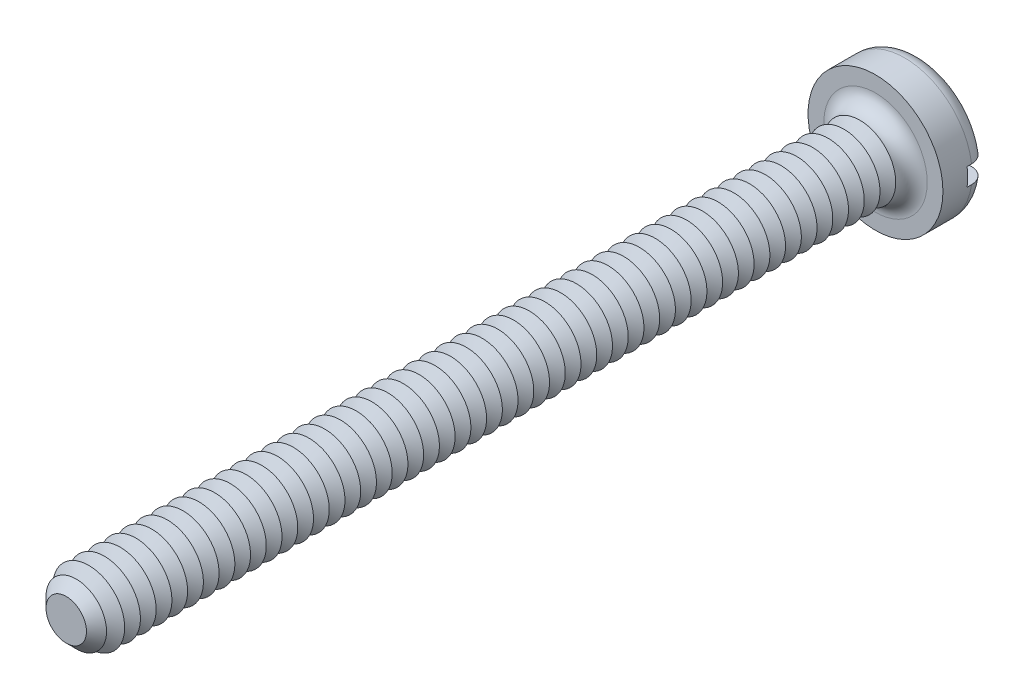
SolidWorks part; units mm, degrees
ref_plane "Front Plane" through (0, 0, 0) normal (0, 0, 1) x (1, 0, 0)
ref_plane "Top Plane" through (0, 0, 0) normal (0, 1, 0) x (1, 0, 0)
ref_plane "Right Plane" through (0, 0, 0) normal (1, 0, 0) x (0, 0, -1)
sketch "Sketch3" plane through (0, 0, 0) normal (0, 0, 1) x (1, 0, 0)
  circle A0 centre (0, 0) radius 1.5
  dimension "D1" = 3
extrude "Boss-Extrude2" add sketch "Sketch3" against normal blind 1
sketch "Sketch4" plane through (0, 0, 0) normal (0, 0, 1) x (1, 0, 0)
  circle A0 centre (0, 0) radius 0.8
  dimension "D1" = 1.6
extrude "Boss-Extrude3" add sketch "Sketch4" along normal blind 18
fillet "Fillet1" radius 0.35 2 edges at (1.5, 0, -1) (0.8, 0, 0)
chamfer "Chamfer1" distance 0.35 angle 45 1 edges at (0.8, 0, 18)
sketch "Sketch5" plane through (0, 0, 0) normal (1, 0, 0) x (0, 0, -1)
  line L0 (1.6944, 0) -> (-7.6738, 0) construction
sketch "Sketch6" plane through (0, 0, 0) normal (1, 0, 0) x (0, 0, -1)
  line L0 (-0.35, 0.8) -> (-0.525, 0.4969)
  line L1 (-0.525, 0.4969) -> (-0.7, 0.8)
  line L2 (-0.35, 0.8) -> (-17.65, 0.8) construction
  line L3 (-0.7, 0.8) -> (-0.35, 0.8)
  dimension "D1" = 0.35
revolve "Cut-Revolve1" cut sketch "Sketch6" angle 360 about L0
pattern_linear "LPattern1" count 50 spacing 0.35 along (0, 0, 1) of "Cut-Revolve1"
sketch "Sketch8" plane through (0, 0, -1) normal (0, 0, -1) x (-1, 0, 0)
  line L1 (1.5, -0.2) -> (-1.5, -0.2)
  line L2 (1.5, -0.2) -> (1.5, 0.2)
  line L3 (1.5, 0.2) -> (-1.5, 0.2)
  line L4 (-1.5, -0.2) -> (-1.5, 0.2)
  line L5 (1.5, -0.2) -> (-1.5, 0.2) construction
  line L6 (1.5, 0.2) -> (-1.5, -0.2) construction
  point P0 (0, 0)
  dimension "D1" = 3
  dimension "D2" = 0.4
extrude "Cut-Extrude1" cut sketch "Sketch8" against normal blind 0.45
